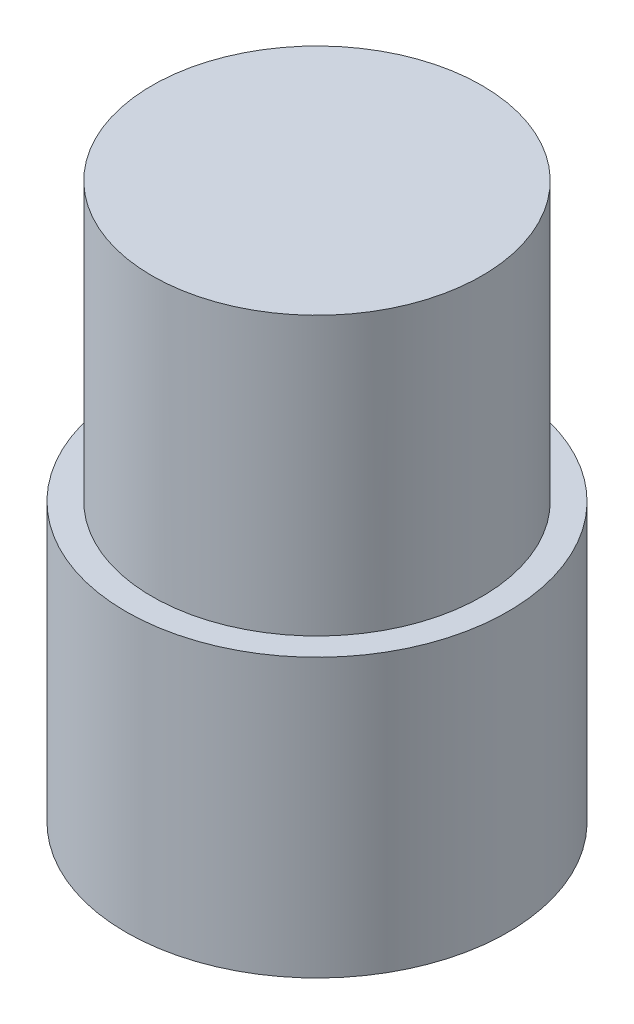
SolidWorks part; units mm, degrees
ref_plane "Front Plane" through (0, 0, 0) normal (0, 0, 1) x (1, 0, 0)
ref_plane "Top Plane" through (0, 0, 0) normal (0, 1, 0) x (1, 0, 0)
ref_plane "Right Plane" through (0, 0, 0) normal (1, 0, 0) x (0, 0, -1)
sketch "Sketch1" plane through (0, 0, 0) normal (0, 1, 0) x (1, 0, 0)
  circle A0 centre (0, 0) radius 1.2065
  dimension "D1" = 2.413
extrude "Boss-Extrude1" add sketch "Sketch1" along normal blind 2.032
sketch "Sketch2" plane through (0, 0, 0) normal (0, -1, 0) x (1, 0, 0)
  circle A0 centre (0, 0) radius 1.397
  dimension "D1" = 2.794
extrude "Boss-Extrude2" add sketch "Sketch2" along normal blind 2.032
